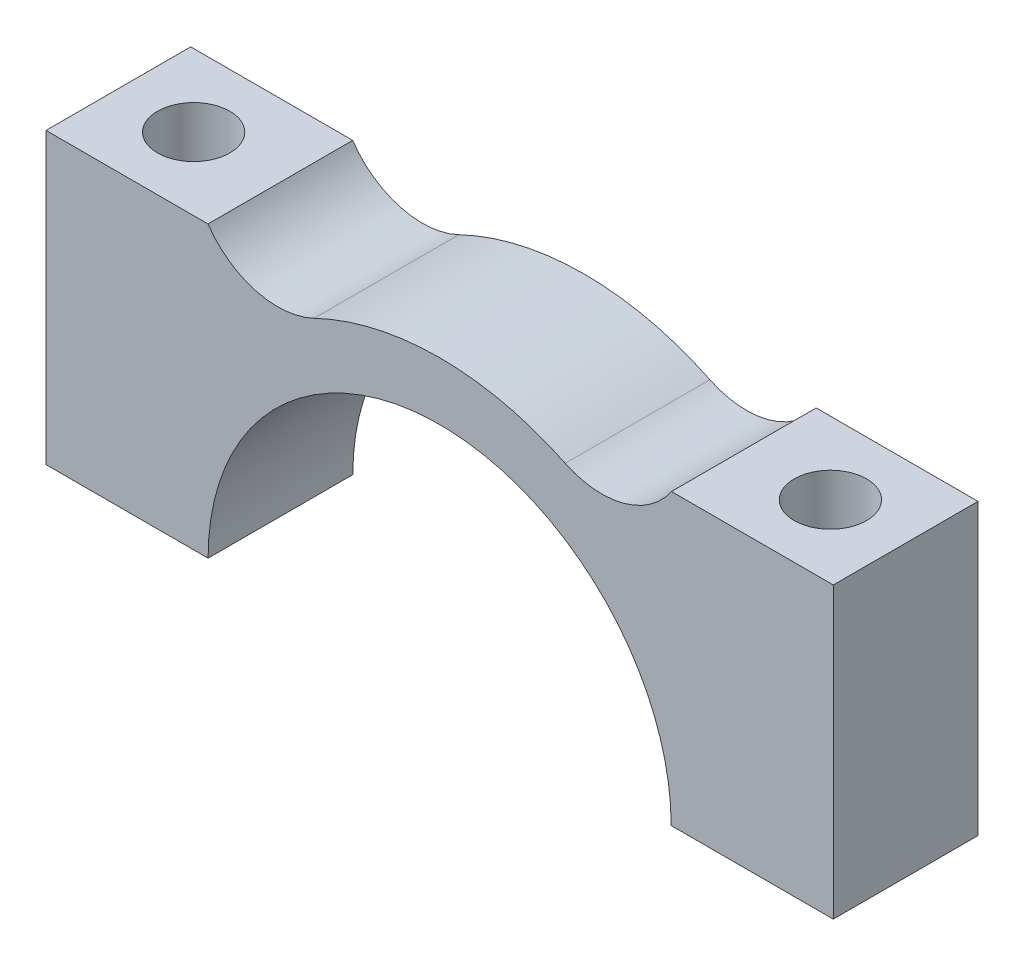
SolidWorks part; units mm, degrees
ref_plane "Front Plane" through (0, 0, 0) normal (0, 0, 1) x (1, 0, 0)
ref_plane "Top Plane" through (0, 0, 0) normal (0, 1, 0) x (1, 0, 0)
ref_plane "Right Plane" through (0, 0, 0) normal (1, 0, 0) x (0, 0, -1)
sketch "Sketch2" plane through (0, 0, 0) normal (0, 0, 1) x (1, 0, 0)
  line L0 (-1000, 0) -> (49000, 0) construction
  line L1 (-8, 0) -> (-13.6, 0)
  line L2 (-13.6, 0) -> (-13.6, 10)
  line L3 (-13.6, 10) -> (-8, 10)
  line L4 (-8, 10) -> (-8, 0)
  line L5 (0, -1000) -> (0, 49000) construction
  line L6 (8, 0) -> (13.6, 0)
  line L7 (13.6, 0) -> (13.6, 10)
  line L8 (13.6, 10) -> (8, 10)
  line L9 (8, 10) -> (8, 0)
  line L10 (-1005.5966, 11.6315) -> (48994.4034, 11.6315) construction
  line L11 (-5.5966, -988.3685) -> (-5.5966, 49011.6315) construction
  line L12 (5.6, -989.3404) -> (5.6, 49010.6596) construction
  circle A0 centre (0, 0) radius 8
  circle A1 centre (0, 0) radius 10
  circle A2 centre (-5.5966, 11.6315) radius 2.9079
  circle A3 centre (5.6, 11.6315) radius 2.9094
  spline S0 degree 1 poles (-8, 10) (0, 10) knots 0 0 1 1
  dimension "D1" = 16
  dimension "D2" = 20
  dimension "D5" = 10
  dimension "D7" = 5.8158
  dimension "D3" = 5.6
  dimension "D4" = 10
  dimension "D6" = 5.6
  dimension "D8" = 5.5966
  dimension "D9" = 5.6
extrude "Boss-Extrude1" add sketch "Sketch2" along normal blind 5
sketch "Sketch3" plane through (0, 10, 0) normal (0, 1, 0) x (1, 0, 0)
  line L0 (-46.0689, -2.5) -> (20.0711, -2.5) construction
  line L1 (0.0011, -1000) -> (0.0011, 49000) construction
  line L2 (-10.9989, -1002.5) -> (-10.9989, 48997.5) construction
  line L3 (11.0011, -1002.5) -> (11.0011, 48997.5) construction
  line L6 (4.3379, 0) -> (-4.3358, 0) construction
  circle A0 centre (-10.9989, -2.5) radius 1.25
  circle A1 centre (11.0011, -2.5) radius 1.25
  point P3 (-12.9989, -2.5)
  point P20 (0.0011, 0)
  dimension "D3" = 2.5
  dimension "D4" = 2.5
  dimension "D1" = 11
  dimension "D2" = 11
extrude "Cut-Extrude1" cut sketch "Sketch3" against normal blind 10
